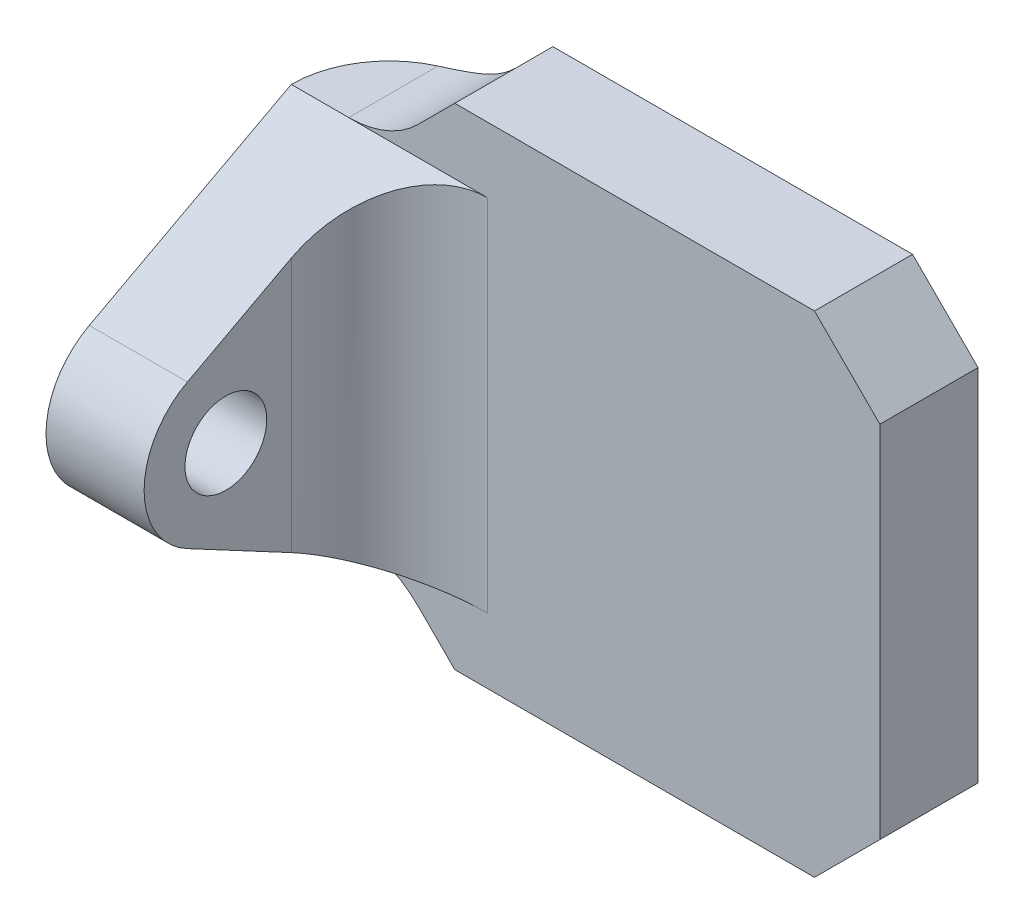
SolidWorks part; units mm, degrees
ref_plane "Ön Düzlem" through (0, 0, 0) normal (0, 0, 1) x (1, 0, 0)
ref_plane "Üst Düzlem" through (0, 0, 0) normal (0, 1, 0) x (1, 0, 0)
ref_plane "Sağ Düzlem" through (0, 0, 0) normal (1, 0, 0) x (0, 0, -1)
sketch "Çizim1" plane through (0, 0, 0) normal (0, 0, 1) x (1, 0, 0)
  line L1 (-7.5, 7.5) -> (7.5, 7.5)
  line L2 (-7.5, 7.5) -> (-7.5, -7.5)
  line L3 (-7.5, -7.5) -> (7.5, -7.5)
  line L4 (7.5, 7.5) -> (7.5, -7.5)
  dimension "D1" = 15
  dimension "D2" = 15
  dimension "D3" = 7.5
  dimension "D4" = 7.5
extrude "Yükseklik-Ekstrüzyon1" add sketch "Çizim1" along normal blind 3
chamfer "Pah1" distance 2 angle 45 4 edges at (-7.5, -7.5, 1.5) (7.5, -7.5, 1.5) (-7.5, 7.5, 1.5) (7.5, 7.5, 1.5)
sketch "Çizim2" plane through (-7.5, 0, 0) normal (-1, 0, 0) x (0, 0, 1)
  line L0 (3, 5.5) -> (3, -5.5) construction
  line L1 (9.1765, 2.2059) -> (3, 5.5)
  line L2 (9.1765, -2.2059) -> (3, -5.5)
  line L5 (3, 5.5) -> (0, 5.5)
  line L7 (3, -5.5) -> (0, -5.5)
  line L8 (0, 5.5) -> (0, -5.5)
  circle A0 centre (8, 0) radius 1.25
  arc A1 (9.1765, -2.2059) -> (9.1765, 2.2059) centre (8, 0) ccw
  dimension "D1" = 2.5
  dimension "D2" = 5
  dimension "D3" = 5
  dimension "D4" = 7
  dimension "D5" = 7
extrude "Yükseklik-Ekstrüzyon2" add sketch "Çizim2" along normal blind 3
fillet "Radyus1" radius 3 1 edges at (-10.5, 0, 0)
fillet "Radyus2" radius 3 2 edges at (-7.5, 5.5, 1.5) (-7.5, -5.5, 1.5)
fillet "Radyus3" radius 3 1 edges at (-7.5, 0, 3)
